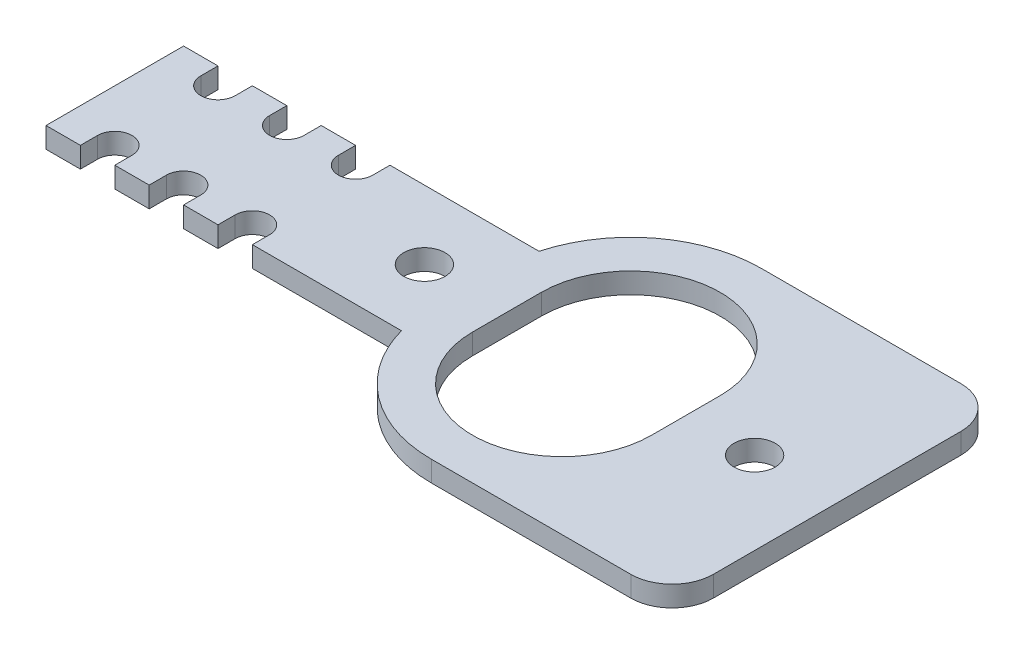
SolidWorks part; units mm, degrees
ref_plane "Front" through (0, 0, 0) normal (0, 0, 1) x (1, 0, 0)
ref_plane "Top" through (0, 0, 0) normal (0, 1, 0) x (1, 0, 0)
ref_plane "Right" through (0, 0, 0) normal (1, 0, 0) x (0, 0, -1)
sketch "Sketch1" plane through (0, 0, 0) normal (0, 1, 0) x (1, 0, 0)
  line L0 (5, 31.5) -> (5, 34)
  line L1 (70, 0) -> (99, 0)
  line L2 (0, 14) -> (0, 34)
  line L3 (70, 48) -> (99, 48)
  line L4 (105, 6) -> (105, 42)
  line L5 (0, 14) -> (5, 14)
  line L6 (0, 34) -> (5, 34)
  line L7 (57, 29) -> (57, 19)
  line L8 (83, 29) -> (83, 19)
  line L9 (10, 31.5) -> (10, 34)
  line L10 (15, 31.5) -> (15, 34)
  line L11 (20, 31.5) -> (20, 34)
  line L12 (25, 31.5) -> (25, 34)
  line L13 (30, 31.5) -> (30, 34)
  line L14 (5, 16.5) -> (5, 14)
  line L15 (10, 16.5) -> (10, 14)
  line L16 (15, 16.5) -> (15, 14)
  line L17 (20, 16.5) -> (20, 14)
  line L18 (25, 16.5) -> (25, 14)
  line L19 (30, 16.5) -> (30, 14)
  line L20 (10, 34) -> (15, 34)
  line L21 (20, 34) -> (25, 34)
  line L22 (30, 34) -> (51.6697, 34)
  line L23 (10, 14) -> (15, 14)
  line L24 (20, 14) -> (25, 14)
  line L25 (30, 14) -> (51.6697, 14)
  circle A0 centre (45, 24) radius 3
  circle A1 centre (93, 24) radius 3
  arc A2 (83, 29) -> (57, 29) centre (70, 29) ccw
  arc A3 (57, 19) -> (83, 19) centre (70, 19) ccw
  arc A4 (70, 48) -> (51.6697, 34) centre (70, 29) ccw
  arc A5 (5, 31.5) -> (10, 31.5) centre (7.5, 31.5) ccw
  arc A6 (15, 31.5) -> (20, 31.5) centre (17.5, 31.5) ccw
  arc A7 (25, 31.5) -> (30, 31.5) centre (27.5, 31.5) ccw
  arc A8 (10, 16.5) -> (5, 16.5) centre (7.5, 16.5) ccw
  arc A9 (51.6697, 14) -> (70, 0) centre (70, 19) ccw
  arc A10 (20, 16.5) -> (15, 16.5) centre (17.5, 16.5) ccw
  arc A11 (30, 16.5) -> (25, 16.5) centre (27.5, 16.5) ccw
  arc A12 (105, 42) -> (99, 48) centre (99, 42) ccw
  arc A13 (99, 0) -> (105, 6) centre (99, 6) ccw
  dimension "D1" = 6
extrude "Extrude1" add sketch "Sketch1" along normal blind 3
